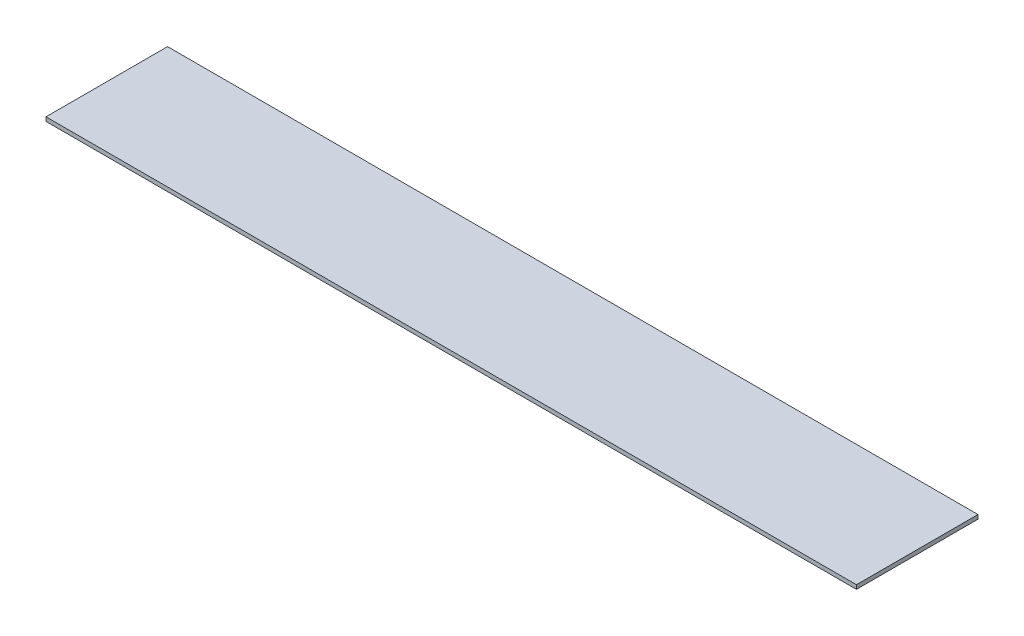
SolidWorks part; units mm, degrees
ref_plane "Plan de face" through (0, 0, 0) normal (0, 0, 1) x (1, 0, 0)
ref_plane "Plan de dessus" through (0, 0, 0) normal (0, 1, 0) x (1, 0, 0)
ref_plane "Plan de droite" through (0, 0, 0) normal (1, 0, 0) x (0, 0, -1)
sketch "Esquisse1" plane through (0, 0, 0) normal (0, 1, 0) x (1, 0, 0)
  line L1 (0, 0) -> (400, 0)
  line L2 (0, 0) -> (0, 60)
  line L3 (0, 60) -> (400, 60)
  line L4 (400, 0) -> (400, 60)
  dimension "D1" = 400
  dimension "D2" = 60
extrude "Extrusion1" add sketch "Esquisse1" along normal blind 2
